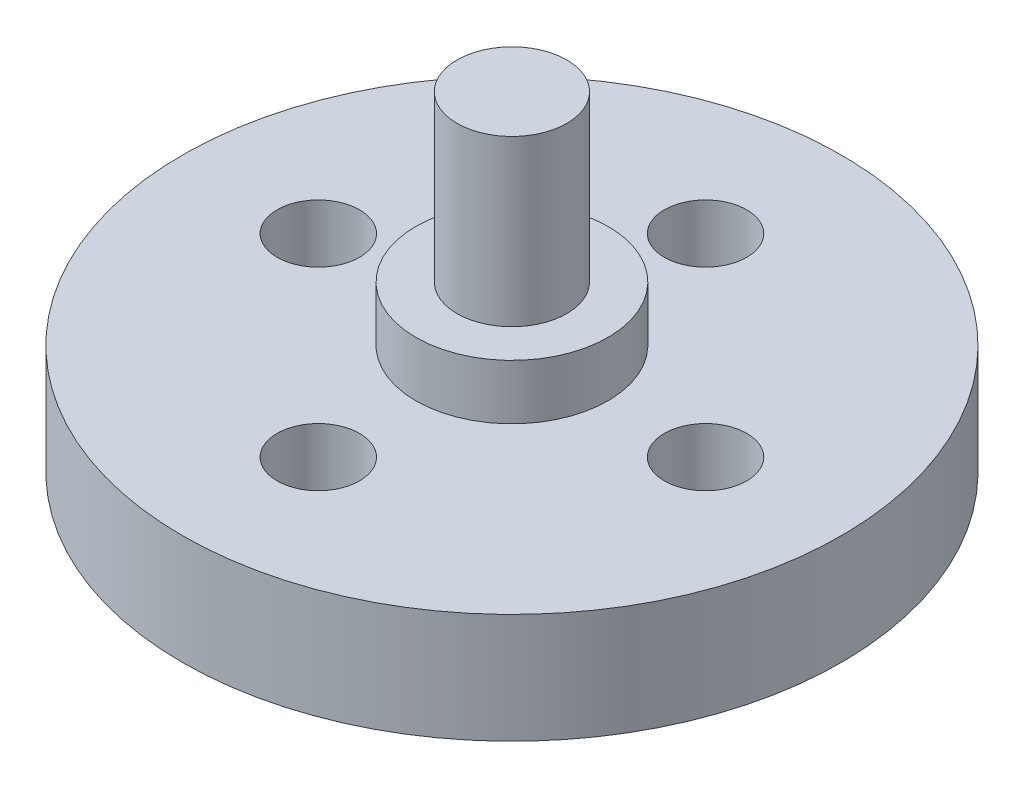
SolidWorks part; units mm, degrees
ref_plane "前视基准面" through (0, 0, 0) normal (0, 0, 1) x (1, 0, 0)
ref_plane "上视基准面" through (0, 0, 0) normal (0, 1, 0) x (1, 0, 0)
ref_plane "右视基准面" through (0, 0, 0) normal (1, 0, 0) x (0, 0, -1)
sketch "草图1" plane through (0, 0, 0) normal (0, 1, 0) x (1, 0, 0)
  circle A0 centre (0, 0) radius 7.05 construction
  circle A1 centre (0, 7.05) radius 1.5
  circle A2 centre (7.05, 0) radius 1.5
  circle A3 centre (0, -7.05) radius 1.5
  circle A4 centre (-7.05, 0) radius 1.5
  circle A6 centre (0, 0) radius 12
  point P14 (0, 0)
  dimension "D1" = 4
extrude "凸台-拉伸1" add sketch "草图1" along normal blind 4
sketch "草图2" plane through (0, 4, 0) normal (0, 1, 0) x (1, 0, 0)
  circle A0 centre (0, 0) radius 2
extrude "凸台-拉伸2" add sketch "草图2" along normal blind 8
sketch "草图3" plane through (0, 4, 0) normal (0, 1, 0) x (1, 0, 0)
  circle A0 centre (0, 0) radius 3.5
extrude "凸台-拉伸3" add sketch "草图3" along normal blind 2
